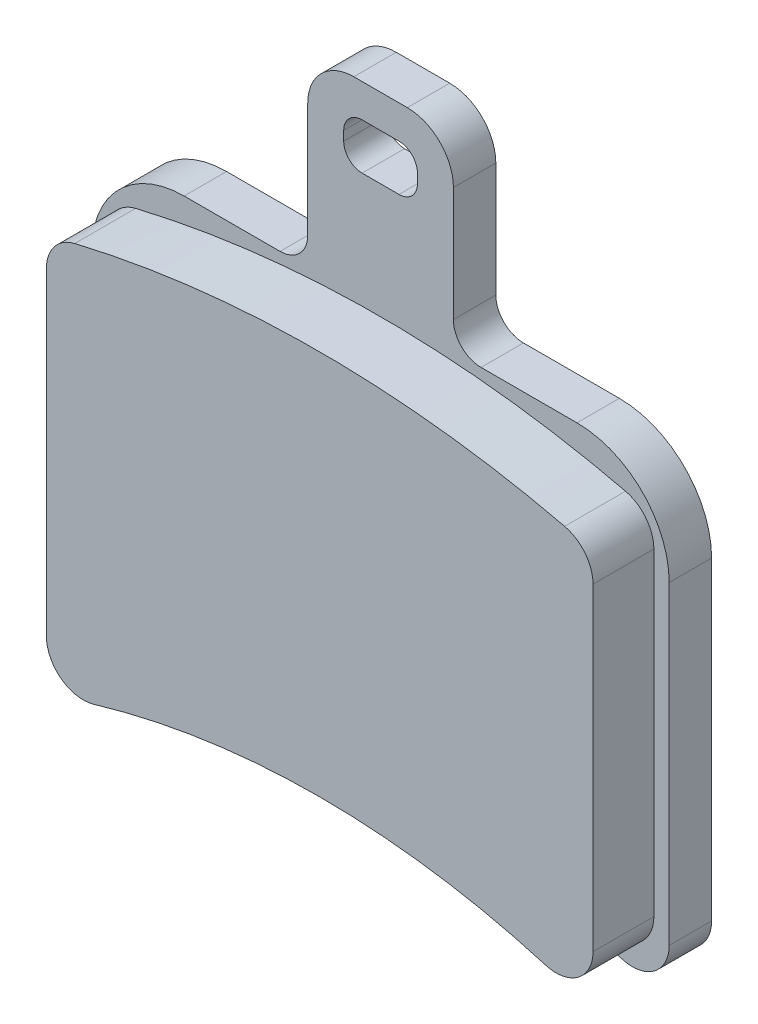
SolidWorks part; units mm, degrees
ref_plane "Front Plane" through (0, 0, 0) normal (0, 0, 1) x (1, 0, 0)
ref_plane "Top Plane" through (0, 0, 0) normal (0, 1, 0) x (1, 0, 0)
ref_plane "Right Plane" through (0, 0, 0) normal (1, 0, 0) x (0, 0, -1)
sketch "Sketch1" plane through (0, 0, 0) normal (0, 0, 1) x (1, 0, 0)
  line L0 (-18.8214, -4.4462) -> (-18.8214, -26.3652)
  line L1 (18.8214, -4.4462) -> (18.8214, -26.3652)
  line L3 (48.5337, -26.543) -> (-50.7046, -26.543) construction
  line L4 (-39.3736, -28.9052) -> (50.0692, -28.9052) construction
  arc A0 (16.8681, -1.9749) -> (-16.8681, -1.9749) centre (0, -73.025) ccw
  arc A1 (15.5596, -28.8005) -> (-15.5596, -28.8005) centre (0, -81.2937) ccw
  arc A2 (18.8214, -4.4462) -> (16.8681, -1.9749) centre (16.2814, -4.4462) ccw
  arc A3 (15.5596, -28.8005) -> (18.8214, -26.3652) centre (16.2814, -26.3652) ccw
  arc A4 (-18.8214, -26.3652) -> (-15.5596, -28.8005) centre (-16.2814, -26.3652) ccw
  arc A5 (-16.8681, -1.9749) -> (-18.8214, -4.4462) centre (-16.2814, -4.4462) ccw
  dimension "D1" = 146.05
  dimension "D2" = 37.6428
  dimension "D4" = 26.543
  dimension "D5" = 2.54
  dimension "D6" = 28.9052
  dimension "D3" = 18.8214
extrude "Extrude1" add sketch "Sketch1" along normal blind 4.191
sketch "Sketch2" plane through (0, 0, 0) normal (0, 0, 1) x (1, 0, 0)
  line L0 (-13.5255, 0.4318) -> (-6.9215, 0.4318)
  line L1 (-5.0165, 2.3368) -> (-5.0165, 10.2108)
  line L2 (-1.8415, 13.3858) -> (1.8415, 13.3858)
  line L3 (5.0165, 10.2108) -> (5.0165, 2.3368)
  line L4 (6.9215, 0.4318) -> (13.5255, 0.4318)
  line L5 (19.8755, -5.9182) -> (19.8755, -27.559)
  line L6 (-19.8755, -5.9182) -> (-19.8755, -27.559)
  line L7 (0, -2.3051) -> (0, 2.3051) construction
  line L8 (2.3051, 0) -> (-2.3051, 0) construction
  line L9 (51.107, -30.099) -> (-57.695, -30.099) construction
  arc A0 (16.5978, -29.9895) -> (-16.5978, -29.9895) centre (0, -84.6762) ccw
  arc A1 (1.8415, 13.3858) -> (5.0165, 10.2108) centre (1.8415, 10.2108) cw
  arc A2 (-5.0165, 10.2108) -> (-1.8415, 13.3858) centre (-1.8415, 10.2108) cw
  arc A3 (6.9215, 0.4318) -> (5.0165, 2.3368) centre (6.9215, 2.3368) cw
  arc A4 (-6.9215, 0.4318) -> (-5.0165, 2.3368) centre (-6.9215, 2.3368) ccw
  arc A5 (19.8755, -5.9182) -> (13.5255, 0.4318) centre (13.5255, -5.9182) ccw
  arc A6 (-19.8755, -5.9182) -> (-13.5255, 0.4318) centre (-13.5255, -5.9182) cw
  arc A7 (16.5978, -29.9895) -> (19.8755, -27.559) centre (17.3355, -27.559) ccw
  arc A8 (-19.8755, -27.559) -> (-16.5978, -29.9895) centre (-17.3355, -27.559) ccw
  point P27 (19.8755, -31.0937)
  dimension "D1" = 114.3
  dimension "D9" = 3.175
  dimension "D10" = 2.54
  dimension "D11" = 6.35
  dimension "D12" = 1.905
  dimension "D2" = 39.751
  dimension "D3" = 19.8755
  dimension "D4" = 10.033
  dimension "D5" = 5.0165
  dimension "D6" = 12.954
  dimension "D7" = 0.4318
  dimension "D8" = 30.5308
extrude "Extrude2" add sketch "Sketch2" against normal blind 2.921
sketch "Sketch3" plane through (0, 0, 0) normal (0, 0, 1) x (1, 0, 0)
  line L0 (-1.27, 11.0998) -> (1.27, 11.0998)
  line L1 (2.54, 9.8298) -> (2.54, 9.1948)
  line L2 (1.27, 7.9248) -> (-1.27, 7.9248)
  line L3 (-2.54, 9.1948) -> (-2.54, 9.8298)
  line L4 (0, -2.3051) -> (0, 2.3051) construction
  line L6 (1.8415, 13.3858) -> (-1.8415, 13.3858) construction
  arc A0 (2.54, 9.1948) -> (1.27, 7.9248) centre (1.27, 9.1948) cw
  arc A1 (1.27, 11.0998) -> (2.54, 9.8298) centre (1.27, 9.8298) cw
  arc A2 (-2.54, 9.8298) -> (-1.27, 11.0998) centre (-1.27, 9.8298) cw
  arc A3 (-1.27, 7.9248) -> (-2.54, 9.1948) centre (-1.27, 9.1948) cw
  dimension "D5" = 1.27
  dimension "D1" = 5.08
  dimension "D2" = 3.175
  dimension "D3" = 2.54
  dimension "D4" = 2.286
extrude "Cut-Extrude1" cut sketch "Sketch3" along direction (0, 0, -1) on the side against the normal up to next (2.921 mm away)
